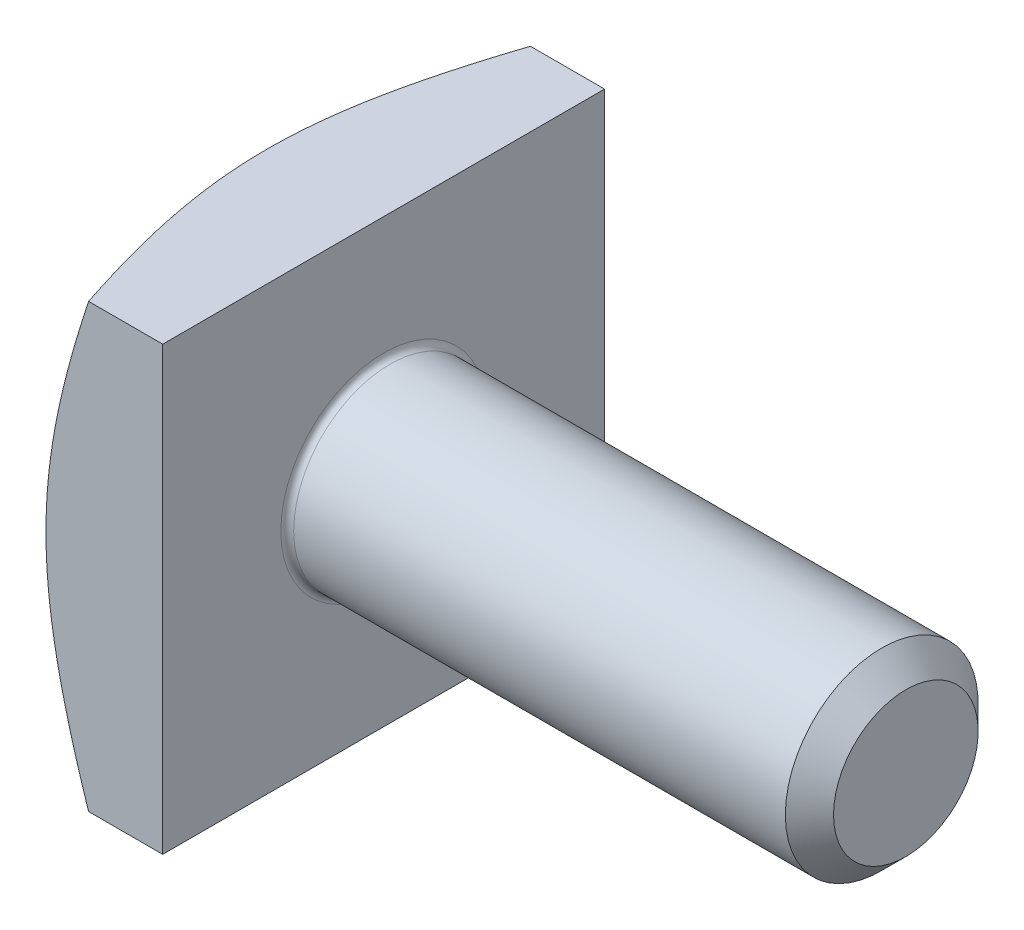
SolidWorks part; units mm, degrees
ref_plane "Front Plane" through (0, 0, 0) normal (0, 0, 1) x (1, 0, 0)
ref_plane "Top Plane" through (0, 0, 0) normal (0, 1, 0) x (1, 0, 0)
ref_plane "Right Plane" through (0, 0, 0) normal (1, 0, 0) x (0, 0, -1)
sketch "BaseHeadSke" plane through (0, 0, 0) normal (1, 0, 0) x (0, 0, -1)
  line L0 (27.5, 27.5) -> (-27.5, -27.5) construction
  line L2 (27.5, 27.5) -> (-27.5, 27.5)
  line L3 (-27.5, 27.5) -> (-27.5, -27.5)
  line L5 (-27.5, -27.5) -> (27.5, -27.5)
  line L6 (27.5, -27.5) -> (27.5, 27.5)
  dimension "Width_flats" = 55
extrude "BaseHead" add sketch "BaseHeadSke" along normal blind 15
sketch "BodySke" plane through (0, 0, 0) normal (0, 0, 1) x (1, 0, 0)
  line L0 (0, 0) -> (80, 0)
  line L1 (80, 0) -> (80, 12)
  line L2 (51.3878, 10.352) -> (123.0174, 10.352) construction
  line L3 (80, 12) -> (0, 12)
  line L4 (0, 12) -> (0, 0)
  line L5 (15, 27.5) -> (15, -27.5) construction
  line L6 (0, 0) -> (159.3976, 0) construction
  line L7 (26, -84.3176) -> (26, 77.7215) construction
  line L8 (77, -21.5941) -> (77, 39.2994) construction
  dimension "Length" = 65
  dimension "Diameter" = 24
  dimension "Minor_dia" = 20.704
  dimension "Thread_length" = 54
  dimension "Advance" = 3
revolve "BaseBody" add sketch "BodySke" angle 360 about L6
sketch "ChamferEndSke" plane through (0, 0, 0) normal (0, 1, 0) x (1, 0, 0)
  line L0 (77, -12) -> (80, -9)
  line L1 (80, -9) -> (80, -12)
  line L2 (80, -12) -> (77, -12)
  line L4 (80, -12) -> (80, 12) construction
  line L5 (15, -12) -> (80, -12) construction
  line L6 (0, 0) -> (120.8692, 0) construction
  dimension "Ang" = 45
  dimension "Chamfer_width" = 3
revolve "ChamferEnd" cut sketch "ChamferEndSke" angle 360 about L6
sketch "CutEndSke" plane through (80, 0, 0) normal (1, 0, 0) x (0, 0, -1)
  circle A0 centre (0, 0) radius 12 construction
  circle A1 centre (0, 0) radius 12
extrude "CutEnd" [suppressed] cut sketch "CutEndSke" against normal blind 3
dome "RoundEnd" [suppressed] faces to dome 1 distance 3 parameters "D1"=3
sketch "HeadChamferSke" plane through (0, 0, 0) normal (0, 0, 1) x (1, 0, 0)
  line L0 (15, 58.6676) -> (0, 58.6676)
  line L1 (0, 58.6676) -> (0, 26.5)
  line L2 (0, 26.5) -> (15, 58.6676)
  line L3 (0, 0) -> (120.9185, 0) construction
  dimension "D1" = 25
  dimension "Head_chamfer" = 53
revolve "HeadChamfer" cut sketch "HeadChamferSke" angle 360 about L3
fillet "Fillet" radius 0.8 1 edges at (15, 0, 12)
sketch "ThdSchSke" plane through (0, 0, 0) normal (0, 0, 1) x (1, 0, 0)
  line L0 (74.5485, 13.9029) -> (74.5485, 12)
  line L1 (74.5485, 12) -> (75.5, 10.352)
  line L2 (75.5, 10.352) -> (76.4515, 12)
  line L3 (76.4515, 12) -> (76.4515, 13.9029)
  line L4 (76.4515, 13.9029) -> (74.5485, 13.9029)
  line L6 (0, 0) -> (141.9934, 0) construction
  line L8 (80, -61.7617) -> (80, 46.755) construction
  line L9 (15, -27.5) -> (15, 27.5) construction
  dimension "D2" = 20.704
  dimension "D3" = 24
  dimension "Advance" = 4.5
  dimension "Length" = 65
revolve "ThreadSchematic" [suppressed] cut sketch "ThdSchSke" angle 360 about L6
pattern_linear "ThdSchPat" [suppressed] count 18 spacing 3 along (1, 0, 0)
equation "\"Thread_minor@ThreadCosmetic\" = \"Minor_dia@BodySke\""
equation "\"Thread_length@ThreadCosmetic\" = \"Thread_length@BodySke\""
equation "\"D1@CutEnd\" = \"Chamfer_width@ChamferEndSke\""
equation "\"D1@RoundEnd\" = \"Chamfer_width@ChamferEndSke\""
equation "\"D2@ThdSchSke\" = \"Minor_dia@BodySke\""
equation "\"D3@ThdSchSke\" = \"Diameter@BodySke\""
equation "\"Length@ThdSchSke\" = \"Length@BodySke\""
equation "\"Advance@ThdSchSke\" = \"Advance@BodySke\"*1.5"
equation "\"D3@ThdSchPat\" = \"Advance@BodySke\""
equation "\"D1@ThdSchPat\" =  int( \"Thread_length@BodySke\"/\"Advance@BodySke\" )"
